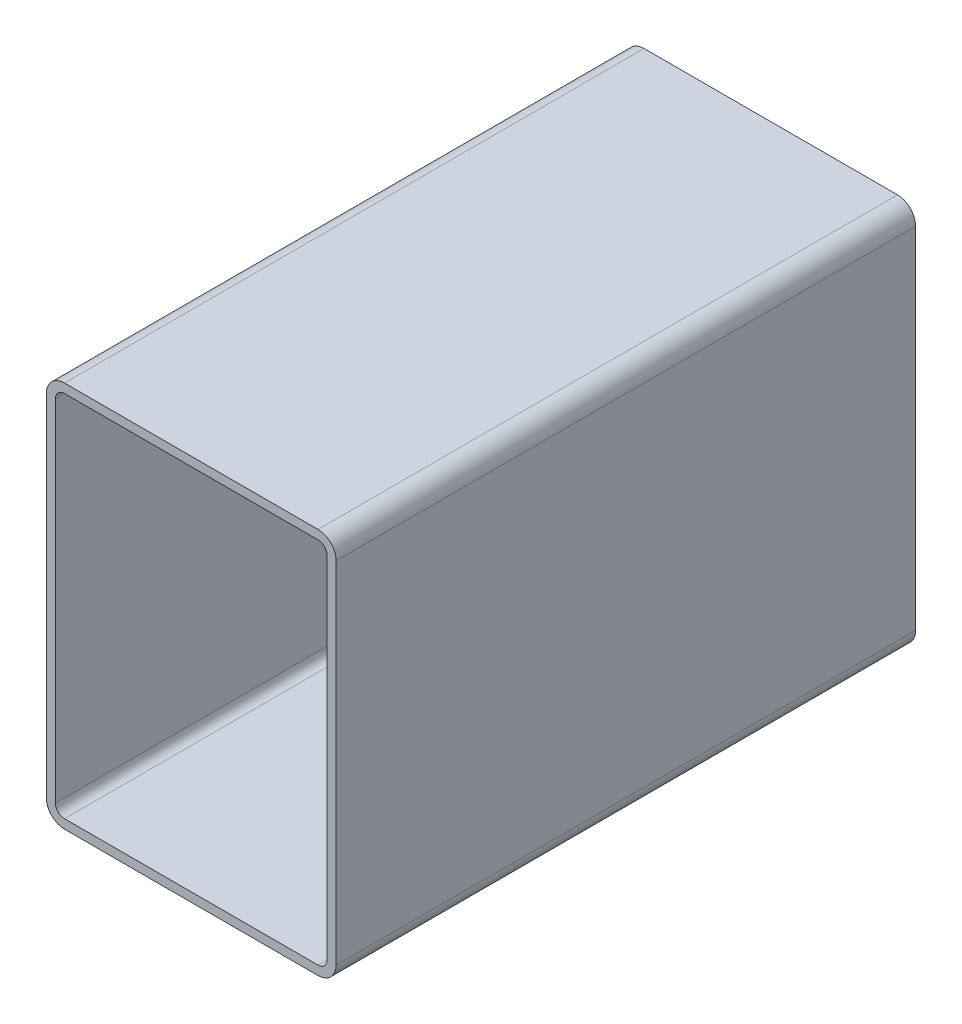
SolidWorks part; units mm, degrees
ref_plane "Front Plane" through (0, 0, 0) normal (0, 0, 1) x (1, 0, 0)
ref_plane "Top Plane" through (0, 0, 0) normal (0, 1, 0) x (1, 0, 0)
ref_plane "Right Plane" through (0, 0, 0) normal (1, 0, 0) x (0, 0, -1)
sketch "Sketch1" plane through (0, 0, 0) normal (0, 0, 1) x (1, 0, 0)
sketch_block_instance "HSS8x6x0.1875-1"
sketch_block "HSS8x6x0.1875"
extrude "Boss-Extrude1" add sketch "Sketch1" along normal blind 304.8
